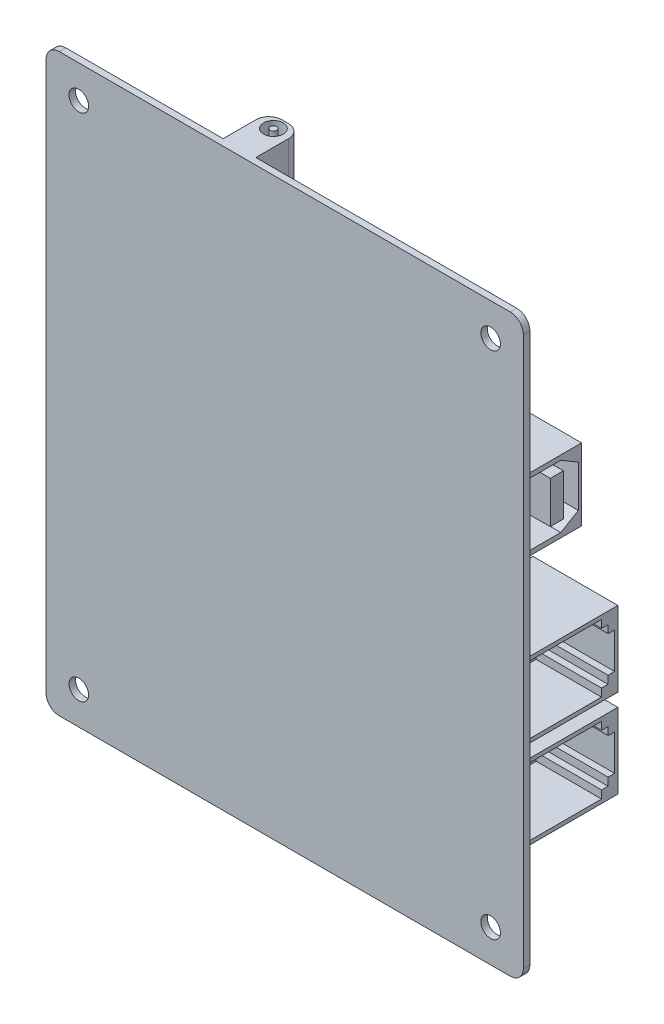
SolidWorks part; units mm, degrees
ref_plane "Plan de face" through (0, 0, 0) normal (0, 0, 1) x (1, 0, 0)
ref_plane "Plan de dessus" through (0, 0, 0) normal (0, 1, 0) x (1, 0, 0)
ref_plane "Plan de droite" through (0, 0, 0) normal (1, 0, 0) x (0, 0, -1)
sketch "Esquisse1" plane through (0, 0, 0) normal (0, 0, 1) x (1, 0, 0)
  line L0 (36.5, 88) -> (36.5, -5.8908) construction
  line L1 (0, 0) -> (73, 0)
  line L2 (0, 0) -> (0, 88)
  line L3 (0, 88) -> (73, 88)
  line L4 (73, 0) -> (73, 88)
  line L5 (97.6722, -105.3091) -> (-55.6611, -105.3091) construction
  line L6 (35.2584, -139.72) -> (-118.075, -139.72) construction
  circle A0 centre (5, 83) radius 1.5
  circle A1 centre (68, 5) radius 1.5
  circle A2 centre (68, 83) radius 1.5
  circle A3 centre (5, 5) radius 1.5
  dimension "D3" = 5
  dimension "D5" = 3
  dimension "D6" = 3
  dimension "D1" = 73
  dimension "D2" = 88
  dimension "D4" = 5
extrude "Carte mère" add sketch "Esquisse1" along normal blind 1
fillet "Congé2" radius 2 4 edges at (0, 88, 0.5) (0, 0, 0.5) (73, 0, 0.5) (73, 88, 0.5)
sketch "Image Carte mère" plane through (0, 0, 0) normal (0, 0, 1) x (1, 0, 0)
  line L0 (34.8682, -138.422) -> (-118.4651, -138.422) construction
sketch "Esquisse6" plane through (0, 0, 0) normal (0, 0, 1) x (1, 0, 0)
  line L0 (59.466, 28.8581) -> (59.466, 17.3581)
  line L1 (72.466, 42.3581) -> (59.466, 42.3581)
  line L2 (72.466, 42.3581) -> (72.466, 30.8581)
  line L3 (72.466, 30.8581) -> (59.466, 30.8581)
  line L4 (59.466, 42.3581) -> (59.466, 30.8581)
  line L5 (72.466, 28.8581) -> (72.466, 17.3581)
  line L6 (72.466, 28.8581) -> (59.466, 28.8581)
  line L7 (72.466, 17.3581) -> (59.466, 17.3581)
  line L8 (14.8167, 42.3581) -> (14.8167, 30.8581)
  line L9 (1.8167, 42.3581) -> (1.8167, 30.8581)
  line L10 (14.8167, 42.3581) -> (1.8167, 42.3581)
  line L14 (14.8167, 28.8581) -> (14.8167, 17.3581)
  line L15 (1.8167, 28.8581) -> (1.8167, 17.3581)
  line L16 (14.8167, 28.8581) -> (1.8167, 28.8581)
  line L17 (14.8167, 30.8581) -> (1.8167, 30.8581)
  line L18 (14.8167, 17.3581) -> (1.8167, 17.3581)
  dimension "D1" = 13
  dimension "D2" = 11.5
  dimension "D3" = 11.5
  dimension "D4" = 11.5
  dimension "D5" = 2
  dimension "D6" = 11.5
  dimension "D7" = 2
extrude "Connexions" add sketch "Esquisse6" against normal blind 14
sketch "Esquisse8" plane through (1.8167, 0, 0) normal (-1, 0, 0) x (0, 0, 1)
  line L0 (-14, 23.1081) -> (0, 23.1081) construction
  line L1 (-14, 28.8581) -> (-14, 17.3581) construction
  line L2 (0, 28.8581) -> (0, 17.3581) construction
  line L3 (-13.5, 25.8581) -> (-13.5, 20.3581)
  line L4 (-13.5, 20.3581) -> (-12.5, 20.3581)
  line L5 (-12.5, 20.3581) -> (-12.5, 19.1581)
  line L6 (-12.5, 19.1581) -> (-11.5, 19.1581)
  line L7 (-11.5, 19.1581) -> (-11.5, 17.9581)
  line L8 (-11.5, 17.9581) -> (-0.5, 17.9581)
  line L9 (-14, 42.3581) -> (0, 42.3581) construction
  line L10 (-0.5, 17.9581) -> (-0.5, 28.2581)
  line L11 (-11.5, 28.2581) -> (-0.5, 28.2581)
  line L12 (-11.5, 27.0581) -> (-11.5, 28.2581)
  line L13 (-12.5, 27.0581) -> (-11.5, 27.0581)
  line L14 (-12.5, 25.8581) -> (-12.5, 27.0581)
  line L15 (-13.5, 25.8581) -> (-12.5, 25.8581)
  line L16 (-12.5, 33.8581) -> (-12.5, 32.6581)
  line L17 (-11.5, 32.6581) -> (-11.5, 31.4581)
  line L18 (-0.5, 31.4581) -> (-0.5, 41.7581)
  line L19 (-13.5, 33.8581) -> (-12.5, 33.8581)
  line L20 (-12.5, 32.6581) -> (-11.5, 32.6581)
  line L21 (-12.5, 40.5581) -> (-11.5, 40.5581)
  line L22 (-11.5, 41.7581) -> (-0.5, 41.7581)
  line L23 (-11.5, 40.5581) -> (-11.5, 41.7581)
  line L24 (-13.5, 39.3581) -> (-13.5, 33.8581)
  line L25 (-12.5, 39.3581) -> (-12.5, 40.5581)
  line L26 (-11.5, 31.4581) -> (-0.5, 31.4581)
  line L27 (-13.5, 39.3581) -> (-12.5, 39.3581)
  line L29 (-14, 30.8581) -> (0, 30.8581) construction
  point P15 (-0.5, 23.1081)
  point P20 (-13.5, 23.1081)
  point P28 (-0.5, 29.8951)
  point P33 (-13.5, 29.8951)
  dimension "D1" = 2.75
  dimension "D2" = 0.5
  dimension "D3" = 1
  dimension "D4" = 1.2
  dimension "D5" = 1
  dimension "D6" = 1.2
  dimension "D7" = 11
  dimension "D8" = 0.6
  dimension "D9" = 0.6
  dimension "D10" = 1.2
  dimension "D11" = 1.2
  dimension "D12" = 1.2
  dimension "D13" = 1.2
  dimension "5.5" = 5.5
sketch "Esquisse10" plane through (72.466, 0, 0) normal (1, 0, 0) x (0, 0, -1)
  line L0 (14, 36.6081) -> (1.6317, 36.6081) construction
  line L1 (14, 30.8581) -> (14, 42.3581) construction
  line L2 (13.5, 33.8581) -> (13.5, 39.3581)
  line L3 (13.5, 39.3581) -> (12.5, 39.3581)
  line L4 (12.5, 39.3581) -> (12.5, 40.5581)
  line L5 (12.5, 40.5581) -> (11.5, 40.5581)
  line L6 (11.5, 40.5581) -> (11.5, 41.7581)
  line L7 (11.5, 41.7581) -> (0.5, 41.7581)
  line L8 (13.5, 20.3581) -> (12.5, 20.3581)
  line L9 (0.5, 41.7581) -> (0.5, 31.4581)
  line L10 (11.5, 31.4581) -> (0.5, 31.4581)
  line L11 (11.5, 32.6581) -> (11.5, 31.4581)
  line L12 (12.5, 32.6581) -> (11.5, 32.6581)
  line L13 (12.5, 33.8581) -> (12.5, 32.6581)
  line L14 (13.5, 33.8581) -> (12.5, 33.8581)
  line L15 (12.5, 27.0581) -> (11.5, 27.0581)
  line L16 (12.5, 25.8581) -> (12.5, 27.0581)
  line L17 (11.5, 27.0581) -> (11.5, 28.2581)
  line L18 (13.5, 20.3581) -> (13.5, 25.8581)
  line L19 (0.5, 28.2581) -> (0.5, 17.9581)
  line L20 (12.5, 20.3581) -> (12.5, 19.1581)
  line L21 (11.5, 17.9581) -> (0.5, 17.9581)
  line L22 (12.5, 19.1581) -> (11.5, 19.1581)
  line L23 (13.5, 25.8581) -> (12.5, 25.8581)
  line L24 (11.5, 19.1581) -> (11.5, 17.9581)
  line L26 (11.5, 28.2581) -> (0.5, 28.2581)
  line L27 (14, 17.3581) -> (0, 17.3581) construction
  line L29 (14, 28.8581) -> (0, 28.8581) construction
  point P13 (0.5, 36.6081)
  point P18 (13.5, 36.6081)
  point P26 (0.5, 19.0634)
  point P31 (13.5, 19.0634)
  dimension "D2" = 1
  dimension "D3" = 1
  dimension "D4" = 1.2
  dimension "D5" = 1.2
  dimension "D6" = 11
  dimension "D7" = 0.5
  dimension "D8" = 0.6
  dimension "D9" = 1.2
  dimension "D10" = 5.5
  dimension "D11" = 1.2
  dimension "D12" = 1.2
  dimension "D13" = 5.5
  dimension "D14" = 0.6
  dimension "D15" = 11
extrude "Intérieur connexions1" cut sketch "Esquisse10" against normal blind 10
extrude "Intérieur connexions 2" cut sketch "Esquisse8" against normal blind 10
sketch "Esquisse11" plane through (0, 0, 0) normal (0, 0, 1) x (1, 0, 0)
  line L1 (70.9156, 65.117) -> (56.9156, 65.117)
  line L2 (70.9156, 65.117) -> (70.9156, 54.117)
  line L3 (70.9156, 54.117) -> (56.9156, 54.117)
  line L4 (56.9156, 65.117) -> (56.9156, 54.117)
  dimension "D1" = 14
  dimension "D2" = 11
extrude "Port USB" add sketch "Esquisse11" against normal blind 10
sketch "Esquisse13" plane through (70.9156, 0, 0) normal (1, 0, 0) x (0, 0, -1)
  line L0 (10, 59.617) -> (-0.2989, 59.617) construction
  line L1 (10, 54.117) -> (10, 65.117) construction
  line L2 (9.5, 56.4178) -> (9.5, 62.8162)
  line L3 (9.5, 62.8162) -> (6.8153, 64.4032)
  line L4 (6.8153, 64.4032) -> (0.7985, 64.4032)
  line L5 (0.7985, 64.4032) -> (0.7985, 54.8308)
  line L6 (6.8153, 54.8308) -> (0.7985, 54.8308)
  line L7 (9.5, 56.4178) -> (6.8153, 54.8308)
  line L9 (7.2047, 62.8162) -> (5.2047, 62.8162)
  line L10 (7.2047, 62.8162) -> (7.2047, 56.4178)
  line L11 (7.2047, 56.4178) -> (5.2047, 56.4178)
  line L12 (5.2047, 62.8162) -> (5.2047, 56.4178)
  point P10 (-0.4591, 59.617)
  point P11 (0.7985, 59.617)
  point P12 (10.5, 59.617)
  point P14 (9.5, 59.617)
  dimension "D1" = 3.1992
  dimension "D2" = 0.5
  dimension "D3" = 6.0168
  dimension "D4" = 2
extrude "intérieur Port USB" cut sketch "Esquisse13" against normal blind 10
sketch "Esquisse15" plane through (0, 0, 0) normal (0, 0, -1) x (-1, 0, 0)
  circle A0 centre (-57.345, 6.6191) radius 4
  circle A1 centre (-57.345, 6.6191) radius 1
extrude "Buzzer" add sketch "Esquisse15" along normal blind 7
sketch "Esquisse16" plane through (0, 0, 0) normal (0, 0, -1) x (-1, 0, 0)
  line L1 (-7.1171, 76.1636) -> (-1.7886, 76.1636)
  line L2 (-7.1171, 76.1636) -> (-7.1171, 64.1636)
  line L3 (-7.1171, 64.1636) -> (-1.7886, 64.1636)
  line L4 (-1.7886, 76.1636) -> (-1.7886, 64.1636)
  dimension "D1" = 12
extrude "Inter" add sketch "Esquisse16" along normal blind 5
sketch "Esquisse19" plane through (1.7886, 0, 0) normal (-1, 0, 0) x (0, 0, 1)
  line L0 (-5, 64.1636) -> (-5, 76.1636) construction
  line L1 (-4, 65.2958) -> (-0.7, 65.2958)
  line L2 (-4, 65.2958) -> (-4, 73.2958)
  line L3 (-4, 73.2958) -> (-0.7, 73.2958)
  line L4 (-0.7, 65.2958) -> (-0.7, 73.2958)
  dimension "D1" = 8
  dimension "D2" = 1
  dimension "D3" = 3.3
extrude "Intérieur Inter" cut sketch "Esquisse19" against normal blind 5
sketch "Esquisse20" plane through (6.7886, 0, 0) normal (-1, 0, 0) x (0, 0, 1)
  line L0 (-0.7, 65.2958) -> (-0.7, 73.2958) construction
  line L1 (-4, 65.2958) -> (-0.7, 65.2958)
  line L2 (-4, 65.2958) -> (-4, 69.2958)
  line L3 (-4, 69.2958) -> (-0.7, 69.2958)
  line L4 (-0.7, 65.2958) -> (-0.7, 69.2958)
  dimension "D1" = 4
extrude "curseur noir Inter" add sketch "Esquisse20" along normal blind 7
sketch "Esquisse23" plane through (0, 0, 0) normal (0, 0, 1) x (1, 0, 0)
  line L0 (71, 88) -> (2, 88) construction
  line L1 (26.0769, 75.6678) -> (31.0769, 75.6678)
  line L2 (26.0769, 75.6678) -> (26.0769, 88)
  line L3 (26.0769, 88) -> (31.0769, 88)
  line L4 (31.0769, 75.6678) -> (31.0769, 88)
  dimension "D1" = 5
extrude "Alim" add sketch "Esquisse23" against normal blind 7
fillet "Congé3" radius 2 2 edges at (31.0769, 81.8339, -7) (26.0769, 81.8339, -7)
sketch "Esquisse25" plane through (0, 88, 0) normal (0, 1, 0) x (1, 0, 0)
  line L1 (26.0769, 5) -> (26.0769, 0) construction
  circle A0 centre (28.5769, 5.1955) radius 1.5
  circle A1 centre (28.5769, 5.1955) radius 0.5
  dimension "D1" = 2.5
extrude "Intérieur alim" cut sketch "Esquisse25" against normal blind 8
sketch "Esquisse27" plane through (0, 0, 0) normal (0, 0, 1) x (1, 0, 0)
  line L1 (21.3805, 9.5363) -> (15.5805, 9.5363)
  line L2 (21.3805, 9.5363) -> (21.3805, 3.7363)
  line L3 (21.3805, 3.7363) -> (15.5805, 3.7363)
  line L4 (15.5805, 9.5363) -> (15.5805, 3.7363)
  dimension "D1" = 5.8
  dimension "D2" = 5.8
extrude "Base BP" add sketch "Esquisse27" against normal blind 2
sketch "Esquisse28" plane through (0, 0, -2) normal (0, 0, -1) x (-1, 0, 0)
  line L0 (-21.3805, 3.7363) -> (-21.3805, 9.5363) construction
  circle A0 centre (-18.4305, 6.7134) radius 1.5
  point P2 (-21.3805, 6.6363)
  dimension "D1" = 2.95
extrude "BP" add sketch "Esquisse28" along normal blind 1
